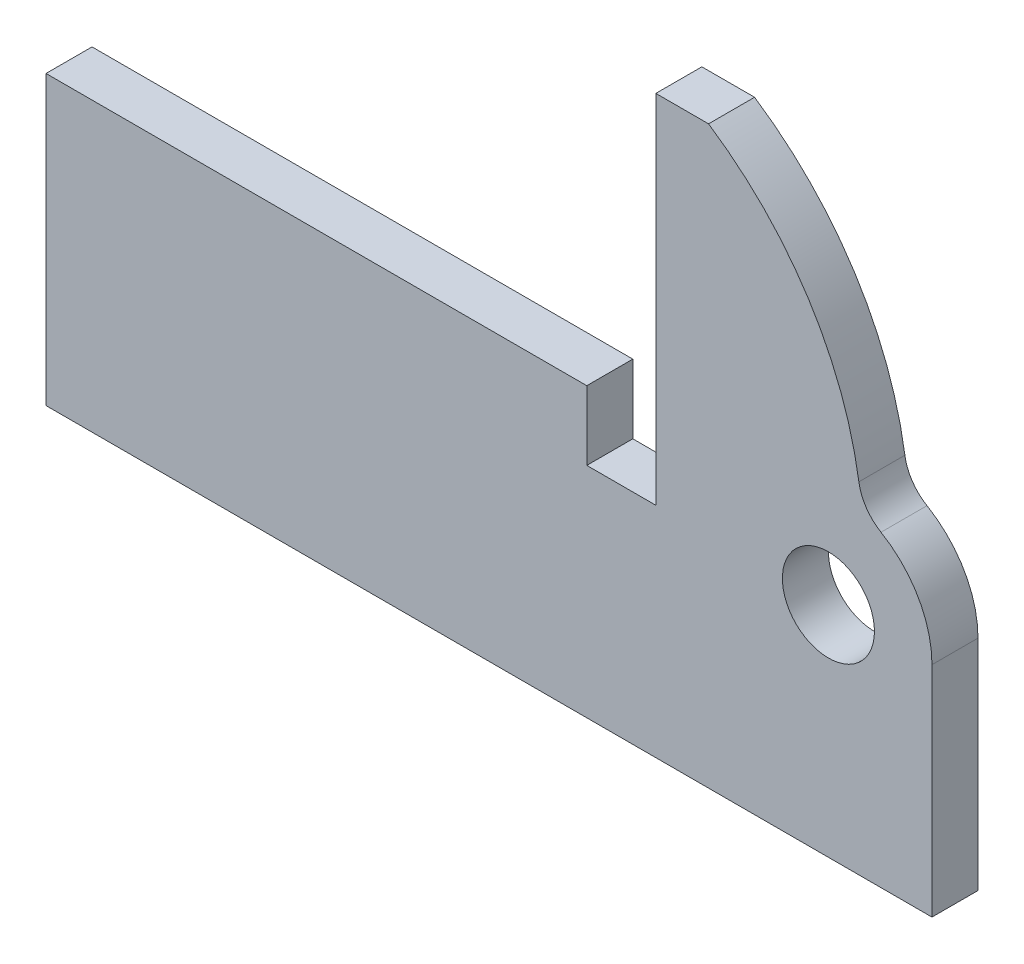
SolidWorks part; units mm, degrees
ref_plane "Front Plane" through (0, 0, 0) normal (0, 0, 1) x (1, 0, 0)
ref_plane "Top Plane" through (0, 0, 0) normal (0, 1, 0) x (1, 0, 0)
ref_plane "Right Plane" through (0, 0, 0) normal (1, 0, 0) x (0, 0, -1)
sketch "Sketch1" plane through (0, 0, 0) normal (0, 0, 1) x (1, 0, 0)
  line L0 (0, 0) -> (77, 0)
  line L1 (77, 0) -> (77, 19)
  line L2 (0, 0) -> (0, 25)
  line L3 (0, 25) -> (47, 25)
  line L4 (47, 25) -> (47, 19)
  line L5 (47, 19) -> (53, 19)
  line L6 (53, 19) -> (53, 50)
  line L7 (53, 50) -> (57.5831, 50)
  line L8 (53, 19) -> (68, 19) construction
  arc A0 (70.6471, 29.5882) -> (72.5692, 26.7538) centre (74.6, 30.2) ccw
  arc A1 (77, 19) -> (72.5692, 26.7538) centre (68, 19) ccw
  arc A2 (70.6471, 29.5882) -> (57.5831, 50) centre (41, 25) ccw
  circle A3 centre (68, 19) radius 4
  dimension "D1" = 4
  dimension "D2" = 9
  dimension "D3" = 47
  dimension "D7" = 30
  dimension "D11" = 8
  dimension "D4" = 25
  dimension "D5" = 24
  dimension "D6" = 6
  dimension "D8" = 25
  dimension "D9" = 19
  dimension "D10" = 12
extrude "Boss-Extrude1" add sketch "Sketch1" along normal blind 4
